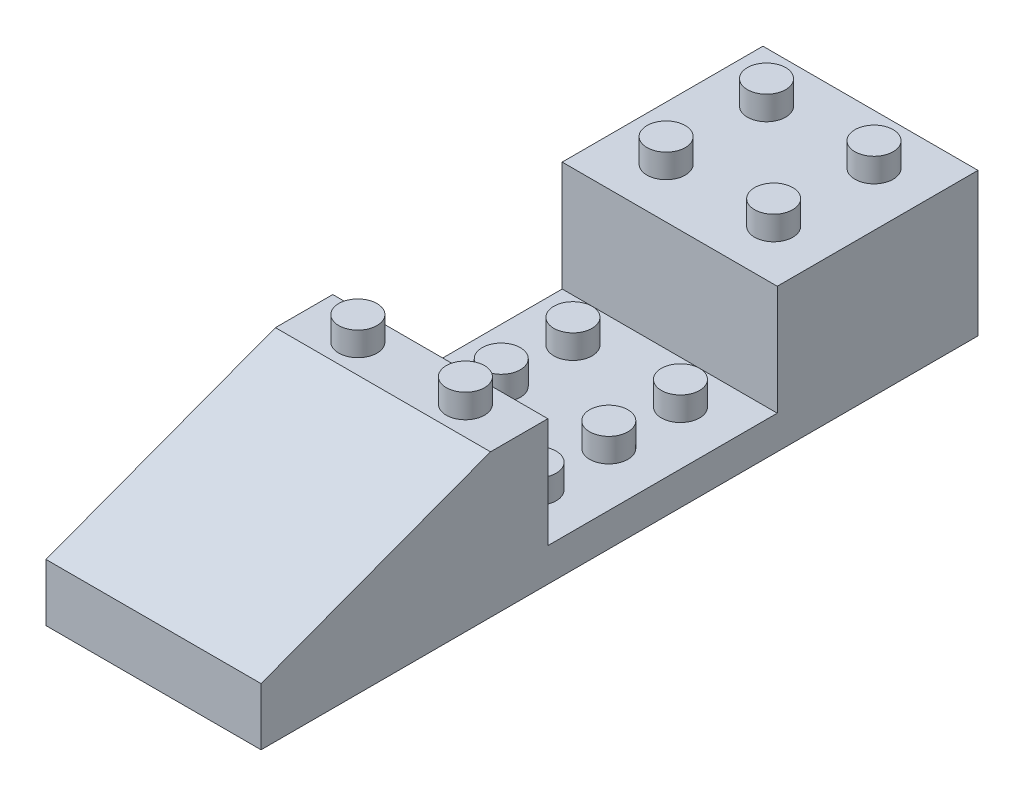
SolidWorks part; units mm, degrees
ref_plane "Front Plane" through (0, 0, 0) normal (0, 0, 1) x (1, 0, 0)
ref_plane "Top Plane" through (0, 0, 0) normal (0, 1, 0) x (1, 0, 0)
ref_plane "Right Plane" through (0, 0, 0) normal (1, 0, 0) x (0, 0, -1)
sketch "Sketch1" plane through (0, 0, 0) normal (1, 0, 0) x (0, 0, -1)
  line L0 (0, 0) -> (150, 0)
  line L1 (150, 0) -> (150, 30)
  line L2 (150, 30) -> (108, 30)
  line L3 (108, 30) -> (108, 7)
  line L4 (108, 7) -> (60, 7)
  line L5 (60, 7) -> (60, 30)
  line L6 (60, 30) -> (48, 30)
  line L7 (48, 30) -> (0, 12)
  line L8 (0, 12) -> (0, 0)
  dimension "D1" = 150
  dimension "D2" = 7
  dimension "D3" = 12
  dimension "D4" = 12
  dimension "D5" = 60
  dimension "D6" = 30
  dimension "D7" = 30
  dimension "D8" = 42
extrude "Boss-Extrude1" add sketch "Sketch1" against normal blind 45
sketch "Sketch2" plane through (0, 30, 0) normal (0, 1, 0) x (1, 0, 0)
  line L0 (-22.5, 54) -> (-45, 54) construction
  line L3 (-22.5, 60) -> (-22.5, 48) construction
  line L4 (-45, 60) -> (0, 60) construction
  line L5 (-45, 48) -> (0, 48) construction
  line L6 (-45, 60) -> (-45, 48) construction
  circle A0 centre (-33.75, 54) radius 4
  circle A1 centre (-11.25, 54) radius 4
  dimension "D1" = 8
extrude "Boss-Extrude4" add sketch "Sketch2" along normal blind 5
sketch "Sketch3" plane through (0, 30, 0) normal (0, 1, 0) x (1, 0, 0)
  line L0 (-22.5, 150) -> (-22.5, 108) construction
  line L1 (-45, 150) -> (0, 150) construction
  line L2 (-45, 108) -> (0, 108) construction
  line L3 (-45, 150) -> (-22.5, 129) construction
  line L4 (-22.5, 129) -> (-45, 108) construction
  circle A0 centre (-33.75, 139.5) radius 4
  circle A1 centre (-33.75, 118.5) radius 4
  circle A2 centre (-11.25, 118.5) radius 4
  circle A3 centre (-11.25, 139.5) radius 4
  dimension "D1" = 8
extrude "Boss-Extrude5" add sketch "Sketch3" along normal blind 5
sketch "Sketch4" plane through (0, 7, 0) normal (0, 1, 0) x (1, 0, 0)
  line L0 (-22.5, 108) -> (-22.5, 60) construction
  line L1 (-45, 108) -> (0, 108) construction
  line L2 (-45, 60) -> (0, 60) construction
  line L3 (-33.75, 60) -> (-33.75, 108) construction
  line L4 (-22.5, 84) -> (-45, 84) construction
  line L5 (-45, 108) -> (-45, 60) construction
  line L6 (-45, 60) -> (0, 60) construction
  line L9 (-45, 108) -> (0, 108) construction
  line L10 (-45, 60) -> (-22.5, 60) construction
  line L11 (-11.25, 60) -> (-11.25, 108) construction
  circle A0 centre (-33.75, 99) radius 4
  circle A1 centre (-33.75, 84) radius 4
  circle A2 centre (-33.75, 69) radius 4
  circle A3 centre (-11.25, 69) radius 4
  circle A4 centre (-11.25, 99) radius 4
  circle A5 centre (-11.25, 84) radius 4
  point P6 (-33.75, 60)
  dimension "D1" = 8
  dimension "D2" = 15
  dimension "D3" = 15
extrude "Boss-Extrude6" add sketch "Sketch4" along normal blind 5
shell "Shell1" thickness 1
sketch "Sketch5" plane through (0, 29, 0) normal (0, -1, 0) x (1, 0, 0)
  line L4 (-1, -149) -> (-1, -109)
  line L5 (-1, -109) -> (-44, -109)
  line L6 (-44, -109) -> (-44, -149)
  line L7 (-44, -149) -> (-1, -149)
  line L8 (-1, -149) -> (-1, -109)
  line L9 (-1, -109) -> (-44, -109)
  line L10 (-44, -109) -> (-44, -149)
  line L11 (-44, -149) -> (-1, -149)
  circle A0 centre (-11.25, -139.5) radius 3 construction
  circle A1 centre (-11.25, -139.5) radius 3
  circle A2 centre (-33.75, -54) radius 3 construction
  circle A3 centre (-11.25, -54) radius 3 construction
  circle A4 centre (-33.75, -139.5) radius 3 construction
  circle A5 centre (-33.75, -118.5) radius 3 construction
  circle A6 centre (-11.25, -118.5) radius 3 construction
  circle A7 centre (-33.75, -54) radius 3
  circle A8 centre (-11.25, -54) radius 3
  circle A9 centre (-33.75, -139.5) radius 3
  circle A10 centre (-33.75, -118.5) radius 3
  circle A11 centre (-11.25, -118.5) radius 3
  circle A12 centre (-11.25, -118.5) radius 4
  circle A13 centre (-11.25, -139.5) radius 4
  circle A14 centre (-33.75, -139.5) radius 4
  circle A15 centre (-33.75, -118.5) radius 4
  circle A16 centre (-11.25, -54) radius 4
  circle A17 centre (-33.75, -54) radius 4
  dimension "D1" = 0
  dimension "D2" = 1
extrude "Boss-Extrude7" add sketch "Sketch5" along normal up to surface (29 mm away) contours A16 A8 | A17 A7 | A13 M6 | A14 M9 | A15 M8 | A12 M7
sketch "Sketch6" plane through (0, 29, 0) normal (0, -1, 0) x (1, 0, 0)
  line L0 (-29.75, -118.5) -> (-15.25, -118.5) construction
  line L1 (-29.8209, -117.75) -> (-23.25, -117.75)
  line L2 (-29.8209, -119.25) -> (-23.25, -119.25)
  line L3 (-37.75, -118.5) -> (-44, -118.5) construction
  line L4 (-44, -149) -> (-44, -109) construction
  line L5 (-44, -117.75) -> (-37.6791, -117.75)
  line L6 (-44, -119.25) -> (-37.6791, -119.25)
  line L7 (-44, -1) -> (-44, -149) construction
  line L8 (-7.25, -118.5) -> (-1, -118.5) construction
  line L9 (-1, -149) -> (-1, -109) construction
  line L10 (-7.3209, -117.75) -> (-1, -117.75)
  line L11 (-7.3209, -119.25) -> (-1, -119.25)
  line L12 (-37.75, -139.5) -> (-44, -139.5) construction
  line L13 (-44, -139.5) -> (-44, -118.5) construction
  line L14 (-44, -129) -> (-1, -129) construction
  line L15 (-44, -117.75) -> (-44, -119.25)
  line L16 (-1, -117.75) -> (-1, -119.25)
  line L17 (-1, -140.25) -> (-1, -138.75)
  line L18 (-7.25, -139.5) -> (-1, -139.5) construction
  line L19 (-7.3209, -138.75) -> (-1, -138.75)
  line L20 (-7.3209, -140.25) -> (-1, -140.25)
  line L21 (-44, -140.25) -> (-44, -138.75)
  line L22 (-44, -140.25) -> (-37.6791, -140.25)
  line L23 (-37.75, -139.5) -> (-44, -139.5) construction
  line L24 (-44, -138.75) -> (-37.6791, -138.75)
  line L25 (-29.75, -139.5) -> (-15.25, -139.5) construction
  line L26 (-29.8209, -140.25) -> (-23.25, -140.25)
  line L27 (-29.8209, -138.75) -> (-23.25, -138.75)
  line L28 (-44, -53.5907) -> (-1, -53.5907) construction
  line L29 (-44, -59) -> (-44, -48.1813) construction
  line L30 (-1, -59) -> (-1, -48.1813) construction
  line L31 (-44, -52.8407) -> (-37.5783, -52.8407)
  line L32 (-44, -54.3407) -> (-37.7355, -54.3407)
  line L33 (-29.9217, -52.8407) -> (-23.25, -52.8407)
  line L34 (-29.7645, -54.3407) -> (-23.25, -54.3407)
  line L35 (-7.4217, -52.8407) -> (-1, -52.8407)
  line L36 (-1, -1) -> (-1, -149) construction
  line L37 (-7.2645, -54.3407) -> (-1, -54.3407)
  line L38 (-1, -52.8407) -> (-1, -54.3407)
  line L39 (-44, -52.8407) -> (-44, -54.3407)
  line L40 (-22.5, -48.1813) -> (-22.5, -59) construction
  line L41 (-44, -48.1813) -> (-1, -48.1813) construction
  line L42 (-44, -149) -> (-1, -149) construction
  line L43 (-23.25, -48.1813) -> (-23.25, -52.8407)
  line L44 (-21.75, -48.1813) -> (-21.75, -52.8407)
  line L45 (-21.75, -52.8407) -> (-15.0783, -52.8407)
  line L46 (-21.75, -54.3407) -> (-15.2355, -54.3407)
  line L47 (-21.75, -54.3407) -> (-21.75, -59)
  line L48 (-21.75, -48.1813) -> (-21.75, -149) construction
  line L49 (-23.25, -54.3407) -> (-23.25, -59)
  line L50 (-23.25, -48.1813) -> (-23.25, -149) construction
  line L51 (-23.25, -48.1813) -> (-21.75, -48.1813)
  line L52 (-23.25, -59) -> (-21.75, -59)
  line L53 (-44, -59) -> (-1, -59) construction
  line L54 (-23.25, -109) -> (-21.75, -109)
  line L55 (-44, -109) -> (-1, -109) construction
  line L56 (-23.25, -149) -> (-21.75, -149)
  line L57 (-21.75, -140.25) -> (-21.75, -149)
  line L58 (-21.75, -138.75) -> (-15.1791, -138.75)
  line L59 (-21.75, -140.25) -> (-15.1791, -140.25)
  line L60 (-23.25, -140.25) -> (-23.25, -149)
  line L61 (-21.75, -109) -> (-21.75, -117.75)
  line L62 (-22.5, -109) -> (-22.5, -149) construction
  line L63 (-22.5, -48.1813) -> (-22.5, -149) construction
  line L64 (-23.25, -109) -> (-23.25, -117.75)
  line L65 (-21.75, -117.75) -> (-15.1791, -117.75)
  line L66 (-21.75, -119.25) -> (-21.75, -138.75)
  line L67 (-23.25, -119.25) -> (-23.25, -138.75)
  line L68 (-21.75, -119.25) -> (-15.1791, -119.25)
  circle A0 centre (-33.75, -118.5) radius 4 construction
  circle A1 centre (-11.25, -118.5) radius 4 construction
  circle A2 centre (-33.75, -118.5) radius 4 construction
  circle A3 centre (-11.25, -118.5) radius 4 construction
  circle A6 centre (-33.75, -139.5) radius 4 construction
  circle A7 centre (-33.75, -139.5) radius 4 construction
  arc A8 (-29.8209, -119.25) -> (-29.8209, -117.75) centre (-33.75, -118.5) ccw
  arc A9 (-15.1791, -117.75) -> (-15.1791, -119.25) centre (-11.25, -118.5) ccw
  arc A10 (-7.3209, -119.25) -> (-7.3209, -117.75) centre (-11.25, -118.5) ccw
  arc A11 (-37.6791, -117.75) -> (-37.6791, -119.25) centre (-33.75, -118.5) ccw
  arc A12 (-7.3209, -138.75) -> (-7.3209, -140.25) centre (-11.25, -139.5) cw
  arc A13 (-15.1791, -140.25) -> (-15.1791, -138.75) centre (-11.25, -139.5) cw
  arc A14 (-37.6791, -140.25) -> (-37.6791, -138.75) centre (-33.75, -139.5) cw
  arc A15 (-29.8209, -138.75) -> (-29.8209, -140.25) centre (-33.75, -139.5) cw
  circle A16 centre (-33.75, -54) radius 4 construction
  circle A17 centre (-33.75, -54) radius 4 construction
  circle A18 centre (-11.25, -54) radius 4 construction
  circle A19 centre (-11.25, -54) radius 4 construction
  arc A20 (-7.2645, -54.3407) -> (-7.4217, -52.8407) centre (-11.25, -54) ccw
  arc A21 (-37.5783, -52.8407) -> (-37.7355, -54.3407) centre (-33.75, -54) ccw
  arc A22 (-29.7645, -54.3407) -> (-29.9217, -52.8407) centre (-33.75, -54) ccw
  arc A23 (-15.0783, -52.8407) -> (-15.2355, -54.3407) centre (-11.25, -54) ccw
  dimension "D1" = 0.75
  dimension "D2" = 0.75
  dimension "D3" = 0.75
  dimension "D4" = 0.75
  dimension "D5" = 0.75
  dimension "D6" = 0.75
extrude "Boss-Extrude9" add sketch "Sketch6" along normal blind 27.5
sketch "Sketch7" plane through (0, 6, 0) normal (0, -1, 0) x (1, 0, 0)
  circle A0 centre (-33.75, -84) radius 3 construction
  circle A1 centre (-33.75, -69) radius 3 construction
  circle A2 centre (-33.75, -99) radius 3 construction
  circle A3 centre (-11.25, -99) radius 3 construction
  circle A4 centre (-11.25, -84) radius 3 construction
  circle A5 centre (-11.25, -69) radius 3 construction
  circle A6 centre (-33.75, -84) radius 3
  circle A7 centre (-33.75, -69) radius 3
  circle A8 centre (-33.75, -99) radius 3
  circle A9 centre (-11.25, -99) radius 3
  circle A10 centre (-11.25, -84) radius 3
  circle A11 centre (-11.25, -69) radius 3
  circle A12 centre (-33.75, -69) radius 4
  circle A13 centre (-11.25, -69) radius 4
  circle A14 centre (-33.75, -84) radius 4
  circle A15 centre (-33.75, -99) radius 4
  circle A16 centre (-11.25, -84) radius 4
  circle A17 centre (-11.25, -99) radius 4
  dimension "D1" = 1
extrude "Boss-Extrude10" add sketch "Sketch7" along normal up to surface (6 mm away)
sketch "Sketch8" plane through (0, 6, 0) normal (0, -1, 0) x (-1, 0, 0)
  line L0 (44, 69) -> (1, 69) construction
  line L1 (21.75, 69.75) -> (15.1791, 69.75)
  line L2 (44, 1) -> (44, 149) construction
  line L3 (1, 109) -> (1, 59) construction
  line L4 (44, 84.75) -> (37.6791, 84.75)
  line L5 (44, 109) -> (44, 59) construction
  line L6 (44, 69.75) -> (37.6791, 69.75)
  line L7 (44, 84) -> (1, 84) construction
  line L8 (44, 99) -> (1, 99) construction
  line L9 (44, 99.75) -> (37.6791, 99.75)
  line L10 (44, 83.25) -> (37.6791, 83.25)
  line L11 (44, 68.25) -> (37.6791, 68.25)
  line L12 (44, 98.25) -> (37.6791, 98.25)
  line L13 (23.25, 109) -> (21.75, 109) construction
  line L14 (22.5, 109) -> (22.5, 59) construction
  line L15 (23.25, 59) -> (21.75, 59) construction
  line L16 (21.75, 109) -> (21.75, 99.75)
  line L17 (23.25, 109) -> (23.25, 99.75)
  line L18 (23.25, 59) -> (21.75, 59)
  line L19 (23.25, 109) -> (21.75, 109)
  line L20 (7.3209, 98.25) -> (1, 98.25)
  line L21 (44, 98.25) -> (1, 98.25) construction
  line L22 (7.3209, 99.75) -> (1, 99.75)
  line L23 (44, 99.75) -> (1, 99.75) construction
  line L24 (29.8209, 98.25) -> (23.25, 98.25)
  line L25 (29.8209, 99.75) -> (23.25, 99.75)
  line L26 (29.8209, 83.25) -> (23.25, 83.25)
  line L27 (44, 83.25) -> (1, 83.25) construction
  line L28 (29.8209, 84.75) -> (23.25, 84.75)
  line L29 (44, 84.75) -> (1, 84.75) construction
  line L30 (7.3209, 84.75) -> (1, 84.75)
  line L31 (7.3209, 83.25) -> (1, 83.25)
  line L32 (21.75, 83.25) -> (15.1791, 83.25)
  line L33 (21.75, 83.25) -> (21.75, 69.75)
  line L34 (21.75, 109) -> (21.75, 59) construction
  line L35 (23.25, 83.25) -> (23.25, 69.75)
  line L36 (23.25, 109) -> (23.25, 59) construction
  line L37 (21.75, 84.75) -> (15.1791, 84.75)
  line L38 (21.75, 98.25) -> (21.75, 84.75)
  line L39 (21.75, 99.75) -> (15.1791, 99.75)
  line L40 (23.25, 98.25) -> (23.25, 84.75)
  line L41 (21.75, 98.25) -> (15.1791, 98.25)
  line L42 (29.8209, 68.25) -> (23.25, 68.25)
  line L43 (44, 68.25) -> (1, 68.25) construction
  line L44 (29.8209, 69.75) -> (23.25, 69.75)
  line L45 (44, 69.75) -> (1, 69.75) construction
  line L46 (21.75, 68.25) -> (15.1791, 68.25)
  line L47 (23.25, 68.25) -> (23.25, 59)
  line L48 (21.75, 68.25) -> (21.75, 59)
  line L49 (7.3209, 68.25) -> (1, 68.25)
  line L50 (7.3209, 69.75) -> (1, 69.75)
  line L51 (44, 68.25) -> (44, 69.75)
  line L52 (44, 83.25) -> (44, 84.75)
  line L53 (44, 98.25) -> (44, 99.75)
  line L54 (1, 98.25) -> (1, 99.75)
  line L55 (1, 83.25) -> (1, 84.75)
  line L56 (1, 68.25) -> (1, 69.75)
  arc A0 (7.3209, 69.75) -> (7.3209, 68.25) centre (11.25, 69) ccw
  circle A2 centre (11.25, 69) radius 4 construction
  circle A3 centre (33.75, 69) radius 4 construction
  circle A4 centre (11.25, 84) radius 4 construction
  circle A5 centre (11.25, 99) radius 4 construction
  circle A6 centre (33.75, 99) radius 4 construction
  circle A7 centre (33.75, 84) radius 4 construction
  arc A8 (15.1791, 68.25) -> (15.1791, 69.75) centre (11.25, 69) ccw
  arc A9 (37.6791, 68.25) -> (37.6791, 69.75) centre (33.75, 69) ccw
  arc A10 (7.3209, 84.75) -> (7.3209, 83.25) centre (11.25, 84) ccw
  arc A11 (7.3209, 99.75) -> (7.3209, 98.25) centre (11.25, 99) ccw
  arc A12 (37.6791, 98.25) -> (37.6791, 99.75) centre (33.75, 99) ccw
  arc A13 (37.6791, 83.25) -> (37.6791, 84.75) centre (33.75, 84) ccw
  arc A14 (15.1791, 98.25) -> (15.1791, 99.75) centre (11.25, 99) ccw
  arc A15 (29.8209, 99.75) -> (29.8209, 98.25) centre (33.75, 99) ccw
  arc A16 (29.8209, 84.75) -> (29.8209, 83.25) centre (33.75, 84) ccw
  arc A17 (15.1791, 83.25) -> (15.1791, 84.75) centre (11.25, 84) ccw
  arc A18 (29.8209, 69.75) -> (29.8209, 68.25) centre (33.75, 69) ccw
  point P6 (33.75, 99)
  dimension "D1" = 0.75
  dimension "D2" = 0.75
  dimension "D3" = 0.75
  dimension "D4" = 0.75
extrude "Boss-Extrude11" add sketch "Sketch8" along normal blind 4.5 contours L46 L48 L18 L47 L42 L44 L35 L26 L28 L40 L24 L25 L17 L19 L16 L39 L41 L38 L37 L32 L33 L1 M7 M6 M45 M46 M5 M44 | L50 L49 M44 M8 | L31 L30 M5 M8 | L12 L9 M22 M45 | L11 A9 L6 L51 | L4 A13 L10 L52 | L22 L54 L20 A11
